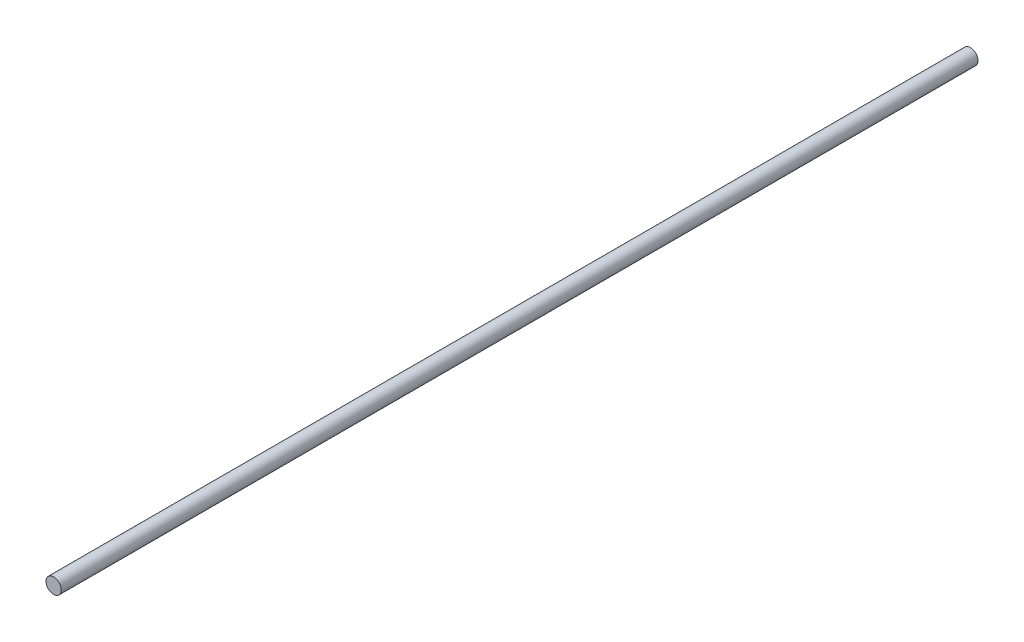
SolidWorks part; units mm, degrees
ref_plane "Front Plane" through (0, 0, 0) normal (0, 0, 1) x (1, 0, 0)
ref_plane "Top Plane" through (0, 0, 0) normal (0, 1, 0) x (1, 0, 0)
ref_plane "Right Plane" through (0, 0, 0) normal (1, 0, 0) x (0, 0, -1)
sketch "Sketch1" plane through (0, 0, 0) normal (0, 0, 1) x (1, 0, 0)
  circle A0 centre (0, 0) radius 30
  dimension "D1" = 60
extrude "Boss-Extrude1" add sketch "Sketch1" against normal blind 3600
